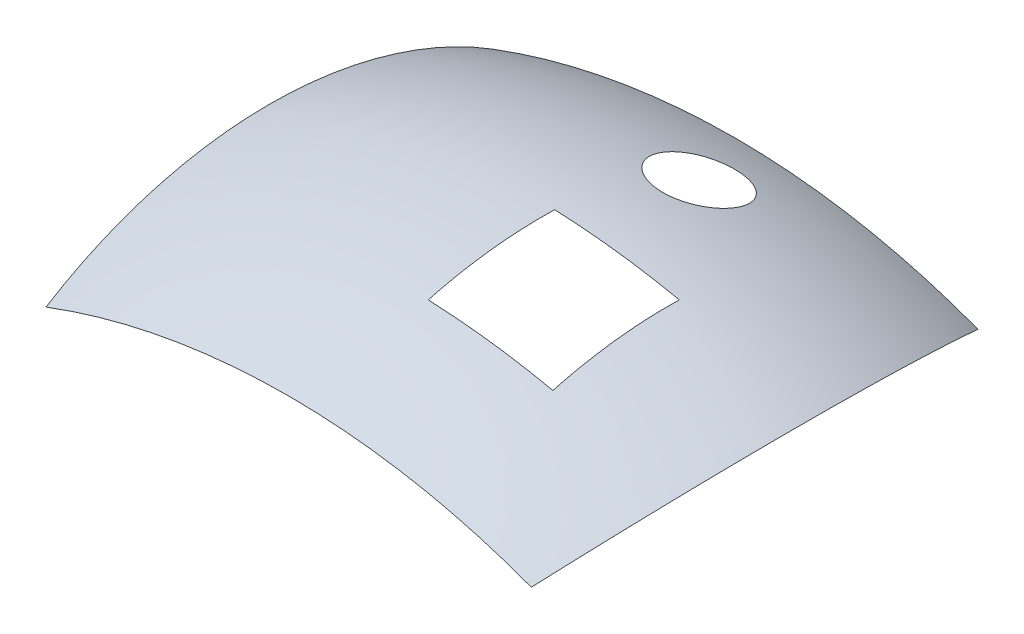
SolidWorks part; units mm, degrees
ref_plane "Front" through (0, 0, 0) normal (0, 0, 1) x (1, 0, 0)
ref_plane "Top" through (0, 0, 0) normal (0, 1, 0) x (1, 0, 0)
ref_plane "Right" through (0, 0, 0) normal (1, 0, 0) x (0, 0, -1)
sketch "Sketch1" plane through (0, 0, 0) normal (0, 0, 1) x (1, 0, 0)
  arc A0 (0, 0) -> (88.832, 0) centre (44.416, -117.5627) cw
sketch "Sketch2" plane through (0, 0, 0) normal (1, 0, 0) x (0, 0, -1)
  arc A0 (0, 0) -> (-81.7669, 0) centre (-40.8834, -65.5649) ccw
surface "Surface-Sweep1"
sketch "Sketch3" plane through (0, 0, 0) normal (0, 1, 0) x (1, 0, 0)
  line L1 (50.095, -38.7586) -> (72.9171, -38.7586)
  line L2 (50.095, -38.7586) -> (50.095, -61.8955)
  line L3 (50.095, -61.8955) -> (72.9171, -61.8955)
  line L4 (72.9171, -38.7586) -> (72.9171, -61.8955)
  circle A0 centre (19.1424, -51.1325) radius 15.2122
  circle A1 centre (54.484, -16.7098) radius 7.4114
surface "Surface-Trim1"
other "DeleteHole6"
